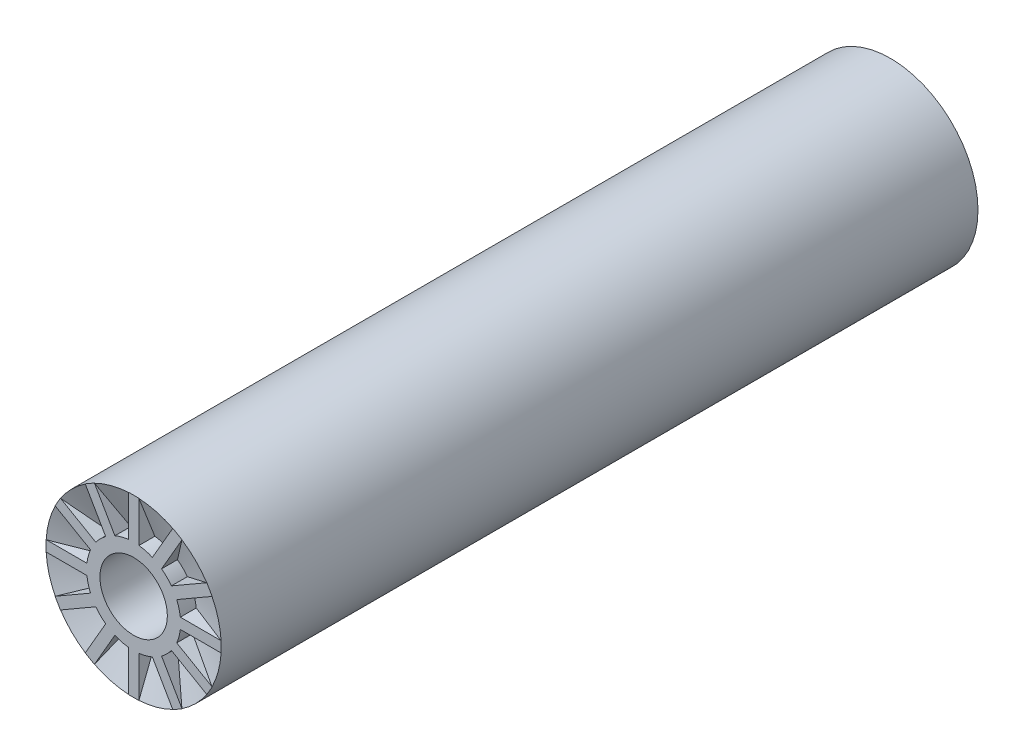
SolidWorks part; units mm, degrees
ref_plane "Front Plane" through (0, 0, 0) normal (0, 0, 1) x (1, 0, 0)
ref_plane "Top Plane" through (0, 0, 0) normal (0, 1, 0) x (1, 0, 0)
ref_plane "Right Plane" through (0, 0, 0) normal (1, 0, 0) x (0, 0, -1)
sketch "Sketch1" plane through (0, 0, 0) normal (1, 0, 0) x (0, 0, -1)
  line L0 (-10, 0) -> (132.5, 0) construction
  line L1 (0, 6.35) -> (-10, 6.35)
  line L3 (-10, 16.5) -> (132.5, 16.5)
  line L4 (132.5, 16.5) -> (132.5, 8)
  line L5 (132.5, 8) -> (129.5, 8)
  line L7 (122.9454, 13.5) -> (-4.65, 13.5)
  line L9 (-4.65, 13.5) -> (0, 8.85)
  line L10 (0, 8.85) -> (0, 6.35)
  line L11 (-10, 6.35) -> (-10, 8.85)
  line L12 (-10, 8.85) -> (-7, 8.85)
  line L13 (-7, 8.85) -> (-10, 16.5)
  line L17 (129.5, 8) -> (122.9454, 13.5)
  point P7 (0, 0)
  dimension "D2" = 16
  dimension "D3" = 33
  dimension "D4" = 3
  dimension "D5" = 10
  dimension "D6" = 3
  dimension "D7" = 3
  dimension "D8" = 12.7
  dimension "D9" = 142.5
  dimension "D10" = 2.5
  dimension "D11" = 45
  dimension "D14" = 50
revolve "Revolve1" add sketch "Sketch1" angle 360 about L0
sketch "Sketch2" plane through (0, 0, 0) normal (0, 1, 0) x (1, 0, 0)
  line L1 (16.5, -10) -> (-16.5, -10) construction
  line L3 (16.5, -10) -> (8.0083, -10)
  line L6 (8.0083, -10.0009) -> (8.0083, -5.8308)
  line L7 (16.5, -10) -> (8.0083, -5.8308)
  line L8 (16.5, -10) -> (8.0083, -10.0009)
extrude "Boss-Extrude1" add sketch "Sketch2" along normal mid plane 2 contours L3 L7 L6
pattern_circular "CirPattern1" count 12 every 30 about axis through (0, 0, 0) along (0, 0, 1) of "Boss-Extrude1"
